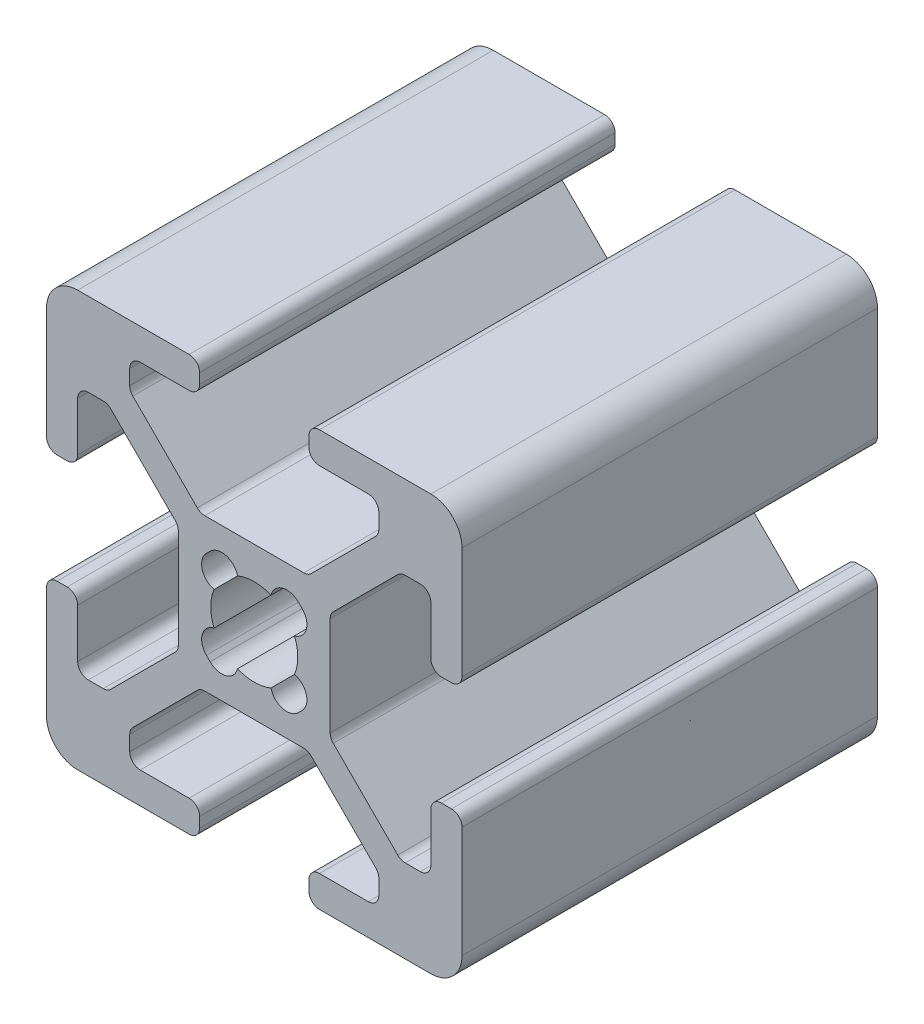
SolidWorks part; units mm, degrees
ref_plane "Front Plane" through (0, 0, 0) normal (0, 0, 1) x (1, 0, 0)
ref_plane "Top Plane" through (0, 0, 0) normal (0, 1, 0) x (1, 0, 0)
ref_plane "Right Plane" through (0, 0, 0) normal (1, 0, 0) x (0, 0, -1)
sketch "Sketch1" plane through (0, 0, 0) normal (0, 0, 1) x (1, 0, 0)
  line L0 (-5.0323, -0.3411) -> (-5.5163, -0.3411)
  line L1 (-6.0243, 0.1669) -> (-6.0243, 2.5159)
  line L2 (-4.5243, 0.1669) -> (-4.5243, 5.5289)
  line L3 (-10.8693, -5.355) -> (-10.8693, -0.5871)
  line L4 (-7.2582, 3.0239) -> (-6.5323, 3.0239)
  line L5 (-7.6174, 2.8752) -> (-10.7205, -0.2279)
  line L6 (-5.0323, -5.6011) -> (-5.5163, -5.6011)
  line L7 (-4.5243, -6.1091) -> (-4.5243, -11.4711)
  line L8 (-6.0243, -6.1091) -> (-6.0243, -8.4581)
  line L9 (-7.2582, -8.9661) -> (-6.5323, -8.9661)
  line L10 (-7.6174, -8.8173) -> (-10.7205, -5.7142)
  line L11 (-12.3994, -5.2756) -> (-12.2198, -5.096)
  line L12 (-17.1543, 6.5209) -> (-17.1543, 6.0369)
  line L13 (-17.6623, 7.0289) -> (-23.0243, 7.0289)
  line L14 (-17.6623, 5.5289) -> (-20.0113, 5.5289)
  line L15 (-12.1404, 0.6839) -> (-16.9082, 0.6839)
  line L16 (-20.5193, 4.295) -> (-20.5193, 5.0209)
  line L17 (-20.3705, 3.9358) -> (-17.2674, 0.8327)
  line L18 (-11.8943, 6.5209) -> (-11.8943, 6.0369)
  line L19 (-11.3863, 7.0289) -> (-6.0243, 7.0289)
  line L20 (-11.3863, 5.5289) -> (-9.0373, 5.5289)
  line L21 (-8.5293, 4.295) -> (-8.5293, 5.0209)
  line L22 (-8.6781, 3.9358) -> (-11.7812, 0.8327)
  line L23 (-12.2198, -0.8462) -> (-12.3994, -0.6666)
  line L24 (-24.0163, -5.6011) -> (-23.5323, -5.6011)
  line L25 (-24.5243, -6.1091) -> (-24.5243, -11.4711)
  line L26 (-23.0243, -6.1091) -> (-23.0243, -8.4581)
  line L27 (-18.1793, -0.5871) -> (-18.1793, -5.355)
  line L28 (-21.7904, -8.9661) -> (-22.5163, -8.9661)
  line L29 (-21.4312, -8.8173) -> (-18.3281, -5.7142)
  line L30 (-24.0163, -0.3411) -> (-23.5323, -0.3411)
  line L31 (-24.5243, 0.1669) -> (-24.5243, 5.5289)
  line L32 (-23.0243, 0.1669) -> (-23.0243, 2.5159)
  line L33 (-21.7904, 3.0239) -> (-22.5163, 3.0239)
  line L34 (-21.4312, 2.8752) -> (-18.3281, -0.2279)
  line L35 (-16.6492, -0.6666) -> (-16.8288, -0.8462)
  line L36 (-11.8943, -12.4631) -> (-11.8943, -11.9791)
  line L37 (-11.3863, -12.9711) -> (-6.0243, -12.9711)
  line L38 (-11.3863, -11.4711) -> (-9.0373, -11.4711)
  line L39 (-16.9082, -6.6261) -> (-12.1404, -6.6261)
  line L40 (-8.5293, -10.2371) -> (-8.5293, -10.9631)
  line L41 (-8.6781, -9.8779) -> (-11.7812, -6.7748)
  line L42 (-17.1543, -12.4631) -> (-17.1543, -11.9791)
  line L43 (-17.6623, -12.9711) -> (-23.0243, -12.9711)
  line L44 (-17.6623, -11.4711) -> (-20.0113, -11.4711)
  line L45 (-20.5193, -10.2371) -> (-20.5193, -10.9631)
  line L46 (-20.3705, -9.8779) -> (-17.2674, -6.7748)
  line L47 (-16.8288, -5.096) -> (-16.6492, -5.2756)
  arc A0 (-15.3283, -4.9062) -> (-13.7203, -4.9062) centre (-14.5243, -2.9711) ccw
  arc A1 (-6.0243, 2.5159) -> (-6.5323, 3.0239) centre (-6.5323, 2.5159) ccw
  arc A2 (-7.2582, 3.0239) -> (-7.6174, 2.8752) centre (-7.2582, 2.5159) ccw
  arc A3 (-10.7205, -0.2279) -> (-10.8693, -0.5871) centre (-10.3613, -0.5871) ccw
  arc A4 (-10.8693, -5.355) -> (-10.7205, -5.7142) centre (-10.3613, -5.355) ccw
  arc A5 (-7.6174, -8.8173) -> (-7.2582, -8.9661) centre (-7.2582, -8.4581) ccw
  arc A6 (-6.5323, -8.9661) -> (-6.0243, -8.4581) centre (-6.5323, -8.4581) ccw
  arc A7 (-5.5163, -5.6011) -> (-6.0243, -6.1091) centre (-5.5163, -6.1091) ccw
  arc A8 (-4.5243, -6.1091) -> (-5.0323, -5.6011) centre (-5.0323, -6.1091) ccw
  arc A9 (-5.0323, -0.3411) -> (-4.5243, 0.1669) centre (-5.0323, 0.1669) ccw
  arc A10 (-6.0243, 0.1669) -> (-5.5163, -0.3411) centre (-5.5163, 0.1669) ccw
  arc A11 (-13.7203, -4.9062) -> (-12.3994, -5.2756) centre (-12.9559, -4.7191) ccw
  arc A12 (-12.2198, -5.096) -> (-12.5892, -3.775) centre (-12.7763, -4.5395) ccw
  arc A13 (-17.1543, 6.5209) -> (-17.6623, 7.0289) centre (-17.6623, 6.5209) ccw
  arc A14 (-17.6623, 5.5289) -> (-17.1543, 6.0369) centre (-17.6623, 6.0369) ccw
  arc A15 (-12.5892, -3.775) -> (-12.5892, -2.1671) centre (-14.5243, -2.9711) ccw
  arc A16 (-17.2674, 0.8327) -> (-16.9082, 0.6839) centre (-16.9082, 1.1919) ccw
  arc A17 (-20.0113, 5.5289) -> (-20.5193, 5.0209) centre (-20.0113, 5.0209) ccw
  arc A18 (-20.5193, 4.295) -> (-20.3705, 3.9358) centre (-20.0113, 4.295) ccw
  arc A19 (-11.8943, 6.0369) -> (-11.3863, 5.5289) centre (-11.3863, 6.0369) ccw
  arc A20 (-11.3863, 7.0289) -> (-11.8943, 6.5209) centre (-11.3863, 6.5209) ccw
  arc A21 (-8.5293, 5.0209) -> (-9.0373, 5.5289) centre (-9.0373, 5.0209) ccw
  arc A22 (-8.6781, 3.9358) -> (-8.5293, 4.295) centre (-9.0373, 4.295) ccw
  arc A23 (-12.1404, 0.6839) -> (-11.7812, 0.8327) centre (-12.1404, 1.1919) ccw
  arc A24 (-12.5892, -2.1671) -> (-12.2198, -0.8462) centre (-12.7763, -1.4027) ccw
  arc A25 (-12.3994, -0.6666) -> (-13.7203, -1.0359) centre (-12.9559, -1.223) ccw
  arc A26 (-24.0163, -5.6011) -> (-24.5243, -6.1091) centre (-24.0163, -6.1091) ccw
  arc A27 (-23.0243, -6.1091) -> (-23.5323, -5.6011) centre (-23.5323, -6.1091) ccw
  arc A28 (-13.7203, -1.0359) -> (-15.3283, -1.0359) centre (-14.5243, -2.9711) ccw
  arc A29 (-18.3281, -5.7142) -> (-18.1793, -5.355) centre (-18.6873, -5.355) ccw
  arc A30 (-23.0243, -8.4581) -> (-22.5163, -8.9661) centre (-22.5163, -8.4581) ccw
  arc A31 (-21.7904, -8.9661) -> (-21.4312, -8.8173) centre (-21.7904, -8.4581) ccw
  arc A32 (-23.5323, -0.3411) -> (-23.0243, 0.1669) centre (-23.5323, 0.1669) ccw
  arc A33 (-24.5243, 0.1669) -> (-24.0163, -0.3411) centre (-24.0163, 0.1669) ccw
  arc A34 (-22.5163, 3.0239) -> (-23.0243, 2.5159) centre (-22.5163, 2.5159) ccw
  arc A35 (-21.4312, 2.8752) -> (-21.7904, 3.0239) centre (-21.7904, 2.5159) ccw
  arc A36 (-18.1793, -0.5871) -> (-18.3281, -0.2279) centre (-18.6873, -0.5871) ccw
  arc A37 (-15.3283, -1.0359) -> (-16.6492, -0.6666) centre (-16.0927, -1.223) ccw
  arc A38 (-16.8288, -0.8462) -> (-16.4594, -2.1671) centre (-16.2723, -1.4027) ccw
  arc A39 (-11.8943, -12.4631) -> (-11.3863, -12.9711) centre (-11.3863, -12.4631) ccw
  arc A40 (-11.3863, -11.4711) -> (-11.8943, -11.9791) centre (-11.3863, -11.9791) ccw
  arc A41 (-16.4594, -2.1671) -> (-16.4594, -3.775) centre (-14.5243, -2.9711) ccw
  arc A42 (-11.7812, -6.7748) -> (-12.1404, -6.6261) centre (-12.1404, -7.1341) ccw
  arc A43 (-9.0373, -11.4711) -> (-8.5293, -10.9631) centre (-9.0373, -10.9631) ccw
  arc A44 (-8.5293, -10.2371) -> (-8.6781, -9.8779) centre (-9.0373, -10.2371) ccw
  arc A45 (-17.1543, -11.9791) -> (-17.6623, -11.4711) centre (-17.6623, -11.9791) ccw
  arc A46 (-17.6623, -12.9711) -> (-17.1543, -12.4631) centre (-17.6623, -12.4631) ccw
  arc A47 (-20.5193, -10.9631) -> (-20.0113, -11.4711) centre (-20.0113, -10.9631) ccw
  arc A48 (-20.3705, -9.8779) -> (-20.5193, -10.2371) centre (-20.0113, -10.2371) ccw
  arc A49 (-16.9082, -6.6261) -> (-17.2674, -6.7748) centre (-16.9082, -7.1341) ccw
  arc A50 (-16.4594, -3.775) -> (-16.8288, -5.096) centre (-16.2723, -4.5395) ccw
  arc A51 (-16.6492, -5.2756) -> (-15.3283, -4.9062) centre (-16.0927, -4.7191) ccw
  arc A52 (-4.5243, 5.5289) -> (-6.0243, 7.0289) centre (-6.0243, 5.5289) ccw
  arc A53 (-6.0243, -12.9711) -> (-4.5243, -11.4711) centre (-6.0243, -11.4711) ccw
  arc A54 (-24.5243, -11.4711) -> (-23.0243, -12.9711) centre (-23.0243, -11.4711) ccw
  arc A55 (-23.0243, 7.0289) -> (-24.5243, 5.5289) centre (-23.0243, 5.5289) ccw
extrude "Boss-Extrude1" add sketch "Sketch1" along normal blind 20
